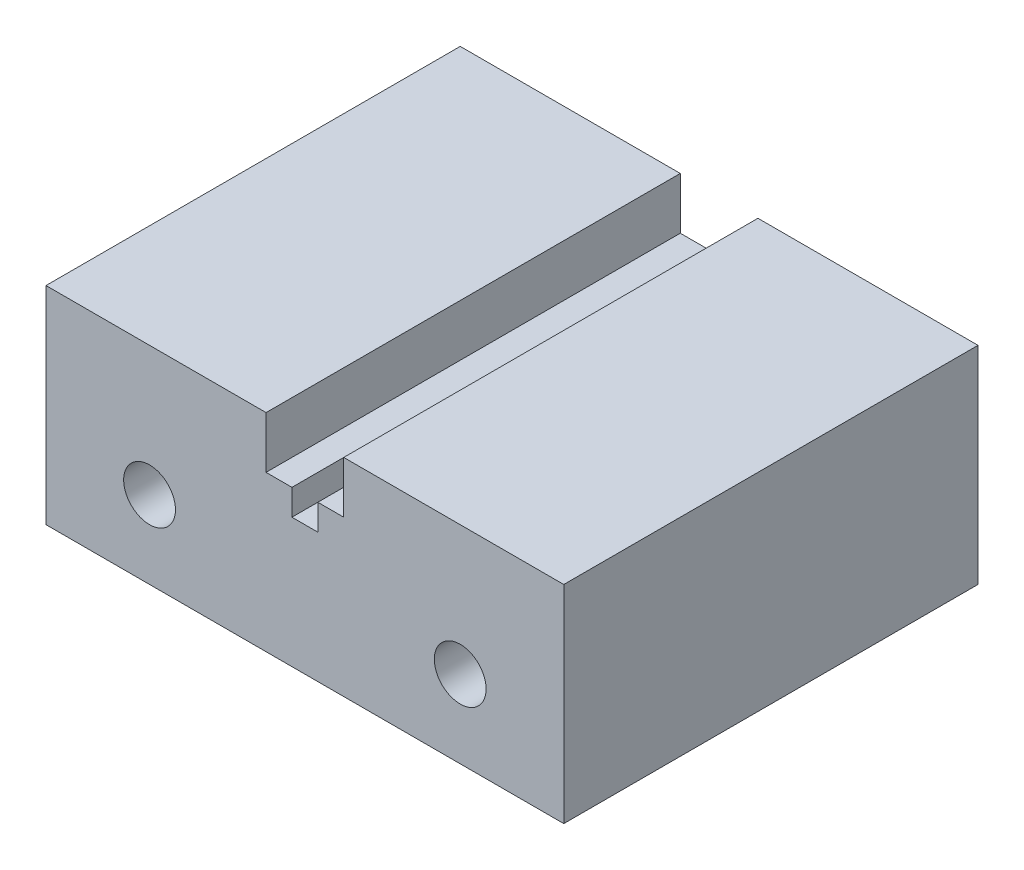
SolidWorks part; units mm, degrees
ref_plane "Front Plane" through (0, 0, 0) normal (0, 0, 1) x (1, 0, 0)
ref_plane "Top Plane" through (0, 0, 0) normal (0, 1, 0) x (1, 0, 0)
ref_plane "Right Plane" through (0, 0, 0) normal (1, 0, 0) x (0, 0, -1)
sketch "Sketch1" plane through (0, 0, 0) normal (0, 0, 1) x (1, 0, 0)
  line L0 (0, 0) -> (100, 0)
  line L1 (0, 0) -> (0, 40)
  line L2 (0, 40) -> (42.5, 40)
  line L3 (100, 0) -> (100, 40)
  line L5 (42.5, 40) -> (42.5, 30)
  line L6 (42.5, 30) -> (47.5, 30)
  line L7 (47.5, 30) -> (47.5, 25)
  line L8 (47.5, 25) -> (52.5, 25)
  line L9 (52.5, 25) -> (52.5, 30)
  line L10 (52.5, 30) -> (57.5, 30)
  line L11 (57.5, 30) -> (57.5, 40)
  line L12 (57.5, 40) -> (100, 40)
  circle A0 centre (20, 15) radius 5
  circle A1 centre (80, 15) radius 5
  dimension "D6" = 10
  dimension "D1" = 60
  dimension "D2" = 20
  dimension "D3" = 15
  dimension "D4" = 40
  dimension "D5" = 100
  dimension "D7" = 10
  dimension "D8" = 5
  dimension "D9" = 5
  dimension "D10" = 5
  dimension "D11" = 42.5
extrude "Boss-Extrude1" add sketch "Sketch1" along normal blind 80
